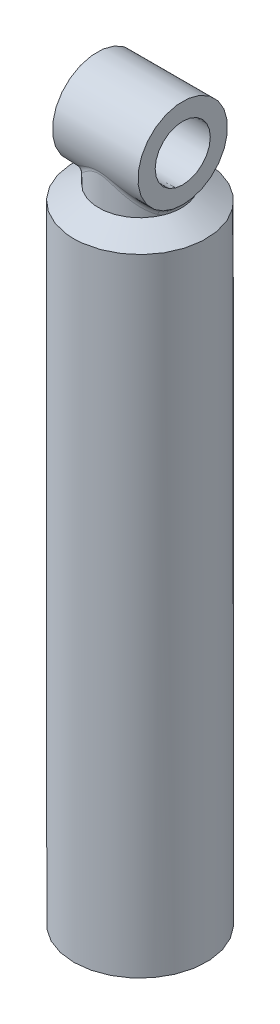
SolidWorks part; units mm, degrees
ref_plane "Plan de face" through (0, 0, 0) normal (0, 0, 1) x (1, 0, 0)
ref_plane "Plan de dessus" through (0, 0, 0) normal (0, 1, 0) x (1, 0, 0)
ref_plane "Plan de droite" through (0, 0, 0) normal (1, 0, 0) x (0, 0, -1)
sketch "Esquisse7" plane through (0, 0, 0) normal (1, 0, 0) x (0, 0, -1)
  circle A0 centre (-1624.1866, 499.5287) radius 20 construction
  circle A1 centre (-1624.1866, 499.5287) radius 32.5
  point P3 (-1624.1866, 479.5287)
  point P4 (-1624.1866, 467.0287)
  dimension "D1" = 65
  dimension "D2" = 12.5
extrude "Boss.-Extru.2" add sketch "Esquisse7" along normal mid plane 62 separate body
sketch "Esquisse8" plane through (0, 0, 0) normal (1, 0, 0) x (0, 0, -1)
  line L0 (-1624.1866, 499.5287) -> (-1624.1866, 210.374) construction
  line L1 (-1654.1866, 489.924) -> (-1647.6562, 478.5185)
  line L2 (-1664.1866, 439.5287) -> (-1664.1866, -60.4713)
  line L3 (-1664.1866, -60.4713) -> (-1646.6866, -60.4713)
  line L4 (-1654.1866, 489.924) -> (-1654.1866, 464.5287)
  line L5 (-1647.6562, 478.5185) -> (-1637.0402, 470.7705)
  line L6 (-1637.0402, 470.7705) -> (-1624.1866, 468.0287)
  line L7 (-1654.1866, 464.5287) -> (-1672.1866, 454.1364)
  line L8 (-1672.1866, 454.1364) -> (-1672.1866, -100.4713)
  line L9 (-1664.1866, 439.5287) -> (-1624.1866, 439.5287)
  line L10 (-1624.1866, 439.5287) -> (-1624.1866, 468.0287)
  line L12 (-1646.6866, -60.4713) -> (-1646.6866, -100.4713)
  line L13 (-1646.6866, -100.4713) -> (-1672.1866, -100.4713)
  circle A0 centre (-1624.1866, 499.5287) radius 31.5 construction
  circle A2 centre (-1624.1866, 499.5287) radius 32.5 construction
  point P2 (-1624.1866, 467.0287)
  dimension "D1" = 80
  dimension "D2" = 45
  dimension "D3" = 8
  dimension "D4" = 1
  dimension "D5" = 40
  dimension "D6" = 600
  dimension "D7" = 60
  dimension "D8" = 35
  dimension "D9" = 30
  dimension "D10" = 30
revolve "Révolution1" add sketch "Esquisse8" angle 360 about L0
sketch "Esquisse9" plane through (0, 0, 0) normal (1, 0, 0) x (0, 0, -1)
  circle A0 centre (-1624.1866, 499.5287) radius 20
  circle A1 centre (-1624.1866, 499.5287) radius 20 construction
extrude "Enlèv. mat.-Extru.1" cut sketch "Esquisse9" against normal mid plane 100
fillet "Congé2" radius 5 1 edges at (-3.884, 486.4392, 1594.4391)
